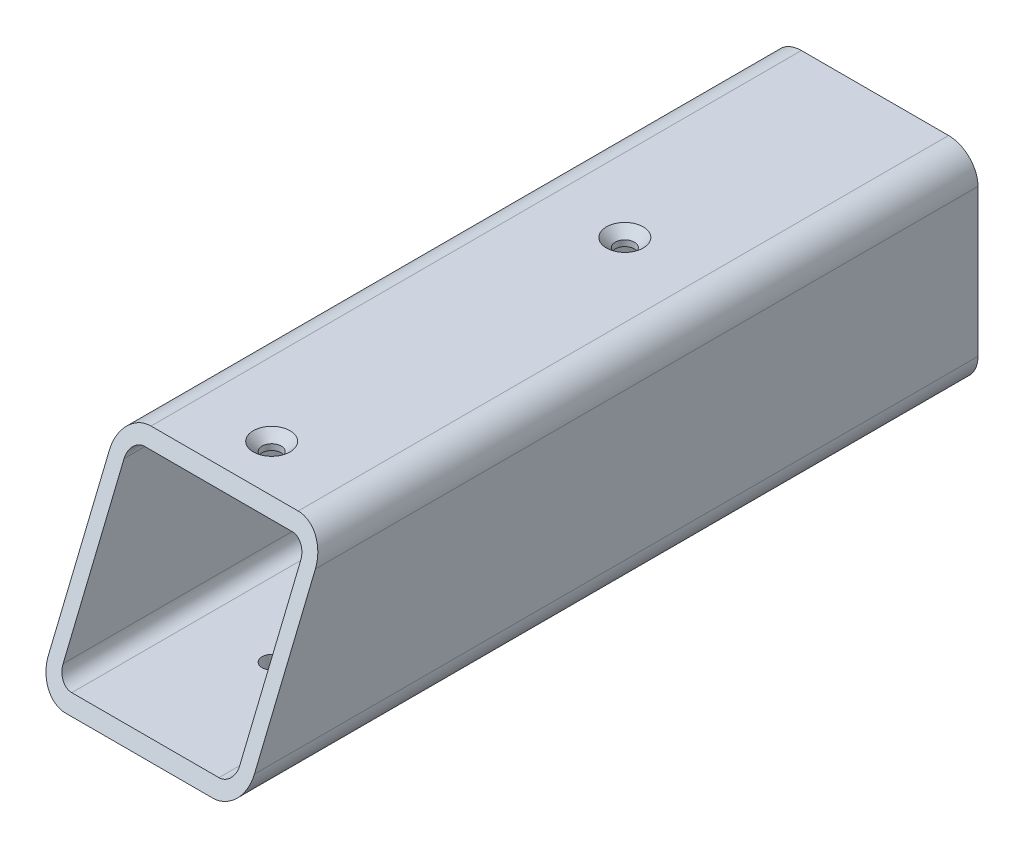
SolidWorks part; units mm, degrees
ref_plane "Plan de face" through (0, 0, 0) normal (0, 0, 1) x (1, 0, 0)
ref_plane "Plan de dessus" through (0, 0, 0) normal (0, 1, 0) x (1, 0, 0)
ref_plane "Plan de droite" through (0, 0, 0) normal (1, 0, 0) x (0, 0, -1)
sketch "Esquisse1" plane through (0, 0, 0) normal (0, 0, 1) x (1, 0, 0)
  line L0 (-25, 30) -> (25, 30)
  line L1 (-25, 35) -> (25, 35)
  line L2 (-35, 25) -> (-35, -25)
  line L3 (-25, -35) -> (25, -35)
  line L4 (35, 25) -> (35, -25)
  line L5 (30, 25) -> (30, -25)
  line L6 (-25, -30) -> (25, -30)
  line L7 (-30, 25) -> (-30, -25)
  arc A0 (-25, -35) -> (-35, -25) centre (-25, -25) cw
  arc A1 (35, 25) -> (25, 35) centre (25, 25) ccw
  arc A2 (-25, 35) -> (-35, 25) centre (-25, 25) ccw
  arc A3 (35, -25) -> (25, -35) centre (25, -25) cw
  arc A4 (30, 25) -> (25, 30) centre (25, 25) ccw
  arc A5 (30, -25) -> (25, -30) centre (25, -25) cw
  arc A6 (-25, -30) -> (-30, -25) centre (-25, -25) cw
  arc A7 (-25, 30) -> (-30, 25) centre (-25, 25) ccw
  point P4 (35, 0)
  point P5 (0, 35)
  dimension "D1" = 10
  dimension "D2" = 10
  dimension "D5" = 5
  dimension "D3" = 70
  dimension "D4" = 70
extrude "Boss.-Extru.1" add sketch "Esquisse1" along normal blind 250
sketch "Esquisse2" plane through (35, 0, 0) normal (1, 0, 0) x (0, 0, -1)
  line L0 (-250, -35) -> (-197.1205, 92.6625)
  line L1 (-250, -35) -> (-250, 79.6701)
  dimension "D1" = 22.5
extrude "Enlèv. mat.-Extru.1" cut sketch "Esquisse2" against normal through all and the other way through all flip side to cut
sketch "Esquisse3" plane through (0, 35, 0) normal (0, 1, 0) x (1, 0, 0)
  line L0 (25, 0) -> (-25, 0) construction
  circle A0 centre (0, -85) radius 3.25
  dimension "D1" = 6.5
  dimension "D2" = 85
extrude "Enlèv. mat.-Extru.2" cut sketch "Esquisse3" against normal up to surface (70 mm away)
chamfer "Chanfrein1" distance 3 angle 45 1 edges at (0, 35, 88.25)
pattern_linear "Répétition linéaire1" count 2 spacing 120 along (0, 0, 1) of "Enlèv. mat.-Extru.2", "Chanfrein1"
